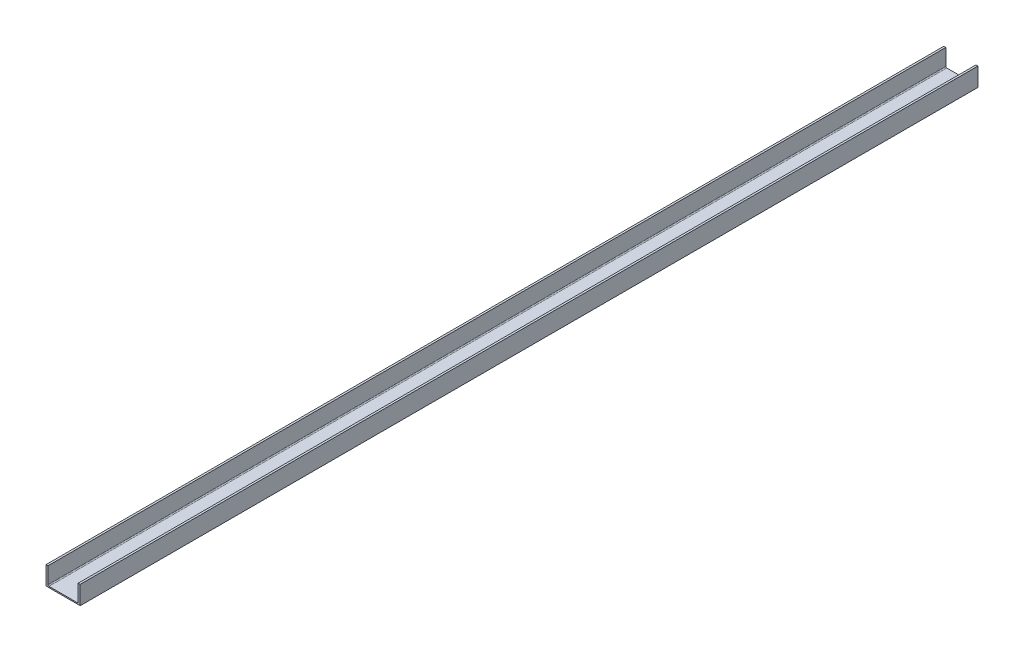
SolidWorks part; units mm, degrees
ref_plane "Front Plane" through (0, 0, 0) normal (0, 0, 1) x (1, 0, 0)
ref_plane "Top Plane" through (0, 0, 0) normal (0, 1, 0) x (1, 0, 0)
ref_plane "Right Plane" through (0, 0, 0) normal (1, 0, 0) x (0, 0, -1)
sketch "Sketch1" plane through (0, 0, 0) normal (0, 0, 1) x (1, 0, 0)
  line L0 (-76.2, 41.275) -> (-76.2, -41.275) construction
  line L1 (-76.2, -41.275) -> (76.2, -41.275) construction
  line L2 (76.2, -41.275) -> (76.2, 41.275) construction
  line L3 (67.31, -35.941) -> (-67.31, -35.941) construction
  line L4 (-67.31, -35.941) -> (-67.31, 41.275) construction
  line L6 (-67.31, 41.275) -> (-76.2, 41.275) construction
  line L7 (0, -41.275) -> (0, 0) construction
  line L8 (76.2, 41.275) -> (67.31, 41.275) construction
  line L9 (67.31, 41.275) -> (67.31, -35.941) construction
  line L10 (0, -35.941) -> (0, -41.275) construction
  point P4 (0, 0)
  point P11 (76.2, -35.941)
sketch "Sketch2" plane through (0, 0, 0) normal (1, 0, 0) x (0, 0, -1)
  line L0 (2000.18, 41.275) -> (-2000.18, 41.275) construction
  line L1 (0, -35.941) -> (0, 41.275) construction
  point P0 (-1847.78, 41.275)
  point P4 (0, 41.275)
  point P6 (1847.78, 41.275)
sketch "Sketch3" plane through (0, 0, 0) normal (0, 0, 1) x (1, 0, 0)
  line L6 (-76.2, 41.275) -> (-76.2, -41.275)
  line L7 (-76.2, -41.275) -> (76.2, -41.275)
  line L8 (76.2, -41.275) -> (76.2, 41.275)
  line L9 (76.2, 41.275) -> (67.31, 41.275)
  line L10 (67.31, 41.275) -> (67.31, -35.941)
  line L11 (67.31, -35.941) -> (-67.31, -35.941)
  line L12 (-67.31, -35.941) -> (-67.31, 41.275)
  line L13 (-67.31, 41.275) -> (-76.2, 41.275)
extrude "Boss-Extrude1" add sketch "Sketch3" along normal mid plane 4000.36
fillet "Fillet1" radius 4.445 2 edges at (67.31, -35.941, 0) (-67.31, -35.941, 0)
equation "\"D1@Boss-Extrude1\"=\"Length@Sketch2\""
equation "\"D2@Sketch2\"=\"D1@Sketch2\""
equation "\"D1@Sketch1\"=\"Outside Height@Sketch1\"/2"
equation "\"D1@Fillet1\"=\"Leg Thickness@Sketch1\"*.5"
equation "\"D1@Sketch2\"=\"Outside Width@Sketch1\"*1"
